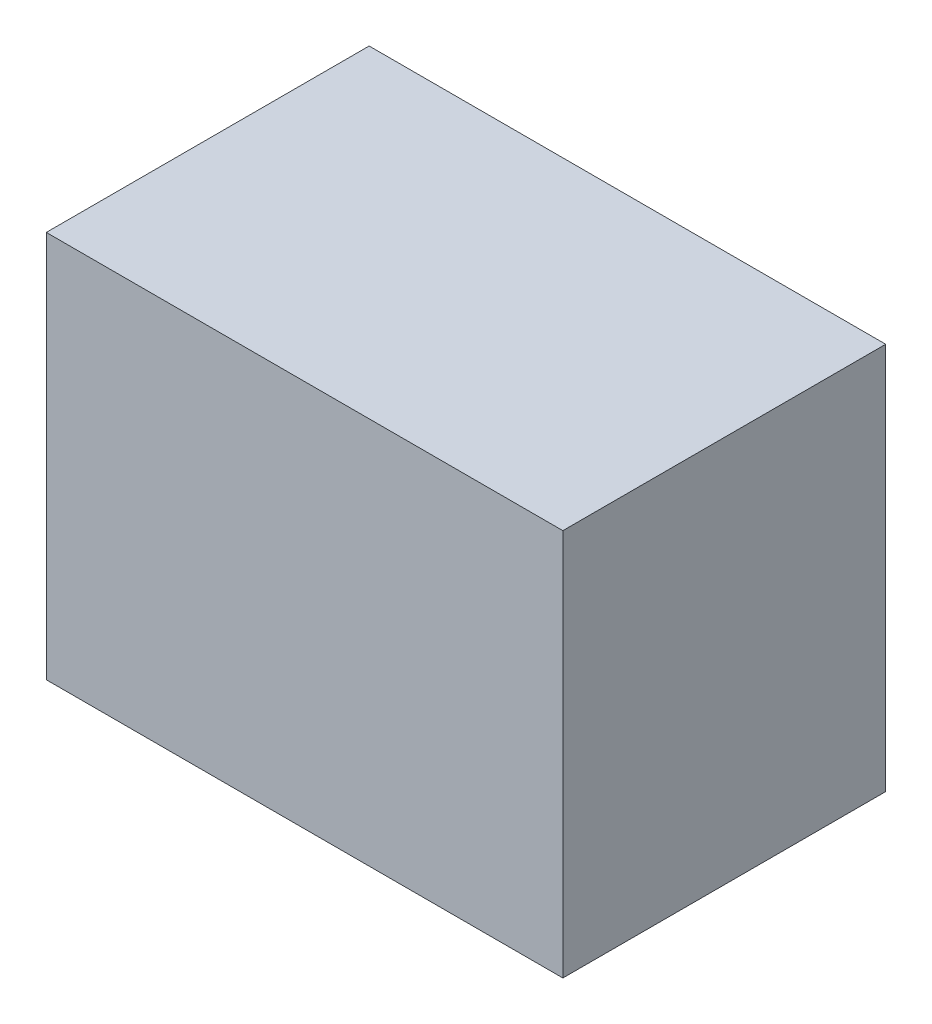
SolidWorks part; units mm, degrees
ref_plane "Front Plane" through (0, 0, 0) normal (0, 0, 1) x (1, 0, 0)
ref_plane "Top Plane" through (0, 0, 0) normal (0, 1, 0) x (1, 0, 0)
ref_plane "Right Plane" through (0, 0, 0) normal (1, 0, 0) x (0, 0, -1)
sketch "Sketch1" plane through (0, 0, 0) normal (0, 0, 1) x (1, 0, 0)
  line L1 (-97.5303, 77.7893) -> (105.6697, 77.7893)
  line L2 (-97.5303, 77.7893) -> (-97.5303, -74.6107)
  line L3 (-97.5303, -74.6107) -> (105.6697, -74.6107)
  line L4 (105.6697, 77.7893) -> (105.6697, -74.6107)
extrude "Extrude1" add sketch "Sketch1" along normal blind 127
sketch "Sketch2" plane through (0, 0, 127) normal (0, 0, 1) x (1, 0, 0)
  line L0 (-97.5303, 77.7893) -> (-97.5303, -74.6107) construction
  line L1 (-97.5303, -74.6107) -> (105.6697, -74.6107) construction
  circle A0 centre (-21.3303, -23.8107) radius 17.4494
  dimension "D1" = 76.2
  dimension "D2" = 50.8
